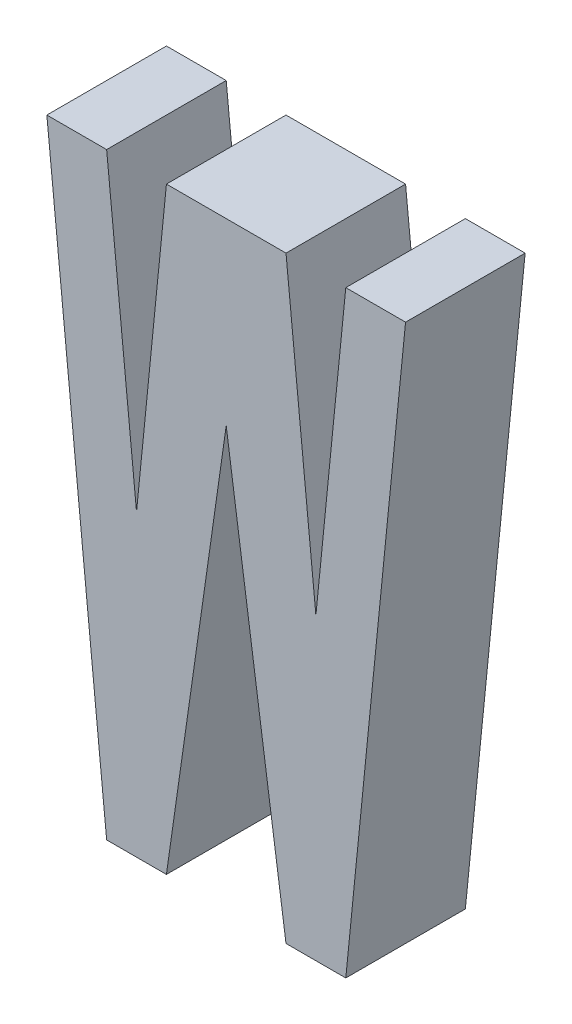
SolidWorks part; units mm, degrees
ref_plane "Plan de face" through (0, 0, 0) normal (0, 0, 1) x (1, 0, 0)
ref_plane "Plan de dessus" through (0, 0, 0) normal (0, 1, 0) x (1, 0, 0)
ref_plane "Plan de droite" through (0, 0, 0) normal (1, 0, 0) x (0, 0, -1)
sketch "Esquisse1" plane through (0, 0, 0) normal (0, 0, 1) x (1, 0, 0)
  line L0 (0, 50) -> (5, 0)
  line L1 (5, 0) -> (10, 0)
  line L3 (0, 50) -> (5, 50)
  line L4 (20, 0) -> (25, 0)
  line L5 (10, 0) -> (15, 35)
  line L6 (15, 35) -> (20, 0)
  line L7 (25, 0) -> (30, 50)
  line L8 (25, 50) -> (22.5, 25)
  line L9 (22.5, 25) -> (20, 50)
  line L10 (10, 50) -> (7.5, 25)
  line L11 (7.5, 25) -> (5, 50)
  line L12 (10, 50) -> (20, 50)
  line L13 (25, 50) -> (30, 50)
  dimension "D3" = 5
  dimension "D4" = 25
  dimension "D5" = 5
  dimension "D6" = 5
  dimension "D7" = 10
  dimension "D8" = 5
  dimension "D11" = 5
  dimension "D12" = 2.5
  dimension "D13" = 2.5
  dimension "D14" = 35
extrude "Boss.-Extru.1" add sketch "Esquisse1" along normal blind 10
